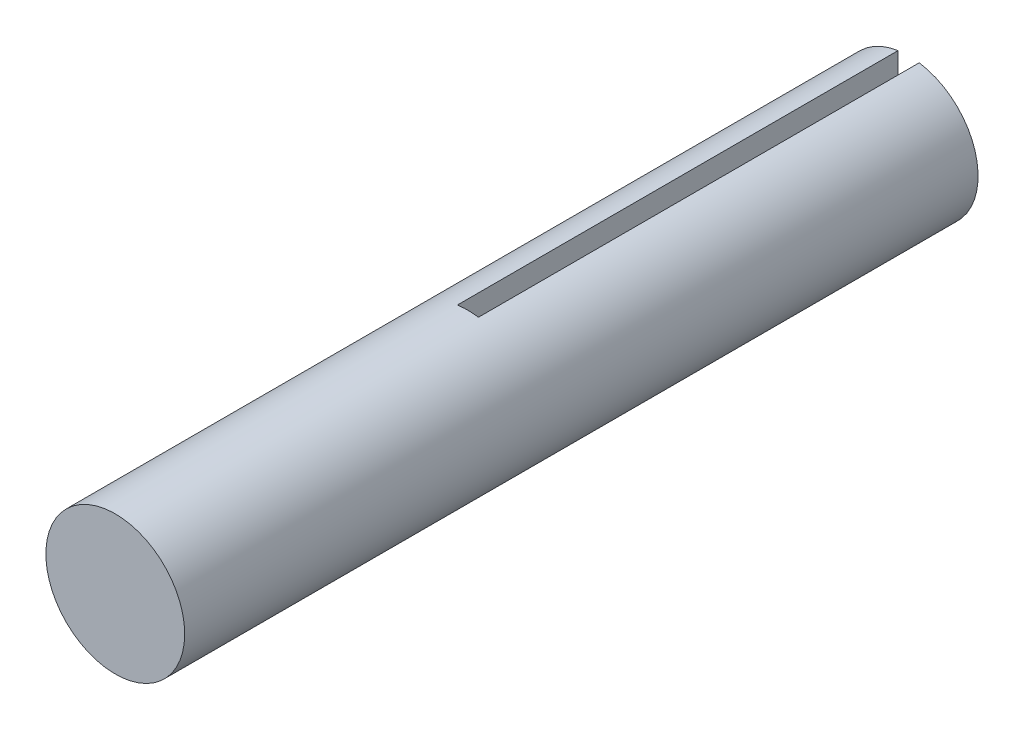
SolidWorks part; units mm, degrees
ref_plane "Front" through (0, 0, 0) normal (0, 0, 1) x (1, 0, 0)
ref_plane "Top" through (0, 0, 0) normal (0, 1, 0) x (1, 0, 0)
ref_plane "Right" through (0, 0, 0) normal (1, 0, 0) x (0, 0, -1)
sketch "Sketch1" plane through (0, 0, 0) normal (0, 0, 1) x (1, 0, 0)
  circle A0 centre (0, 0) radius 0.9969
  circle A1 centre (0, 0) radius 1.5
  dimension "D1" = 1.9939
  dimension "D2" = 3
extrude "Extrude1" add sketch "Sketch1" along normal blind 9.525
sketch "Sketch2" plane through (0, 0, 0) normal (0, 0, 1) x (1, 0, 0)
  line L1 (-0.2286, 1.6522) -> (0.2286, 1.6522)
  line L2 (-0.2286, 1.6522) -> (-0.2286, 0.7178)
  line L3 (-0.2286, 0.7178) -> (0.2286, 0.7178)
  line L4 (0.2286, 1.6522) -> (0.2286, 0.7178)
  point P4 (0, 0.7178)
  dimension "D1" = 0.4572
extrude "Cut-Extrude1" cut sketch "Sketch2" along normal through all
sketch "Sketch3" plane through (0, 0, 0) normal (0, 0, -1) x (-1, 0, 0)
  circle A0 centre (0, 0) radius 0.9969
  circle A1 centre (0, 0) radius 0.997 construction
extrude "Extrude2" [suppressed] add sketch "Sketch3" against normal blind 3.7
sketch "Sketch4" plane through (0, 0, 9.525) normal (0, 0, 1) x (1, 0, 0)
  circle A0 centre (0, 0) radius 1.5
extrude "Extrude3" add sketch "Sketch4" along normal blind 7.62
